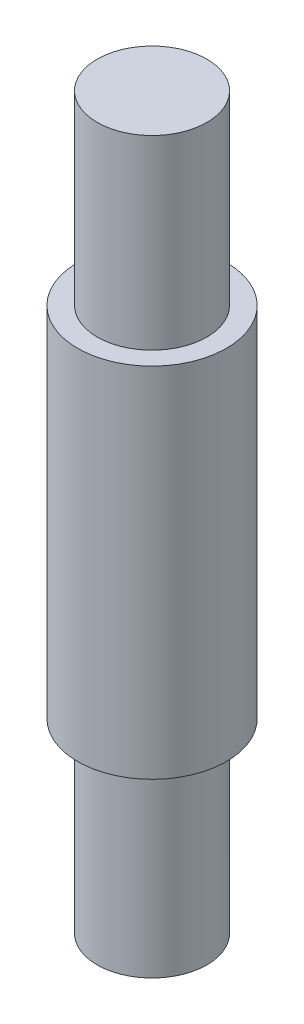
SolidWorks part; units mm, degrees
ref_plane "Front Plane" through (0, 0, 0) normal (0, 0, 1) x (1, 0, 0)
ref_plane "Top Plane" through (0, 0, 0) normal (0, 1, 0) x (1, 0, 0)
ref_plane "Right Plane" through (0, 0, 0) normal (1, 0, 0) x (0, 0, -1)
sketch "Sketch1" plane through (0, 0, 0) normal (0, 1, 0) x (1, 0, 0)
  circle A0 centre (0, 0) radius 0.8
  dimension "D1" = 1.6
extrude "Boss-Extrude1" add sketch "Sketch1" along normal blind 3.85
sketch "Sketch2" plane through (0, 3.85, 0) normal (0, 1, 0) x (1, 0, 0)
  circle A0 centre (0, 0) radius 0.59
  dimension "D1" = 1.18
extrude "Boss-Extrude2" add sketch "Sketch2" along normal blind 2
sketch "Sketch3" plane through (0, 0, 0) normal (0, -1, 0) x (1, 0, 0)
  circle A0 centre (0, 0) radius 0.59
  dimension "D1" = 1.18
extrude "Boss-Extrude3" add sketch "Sketch3" along normal blind 2
